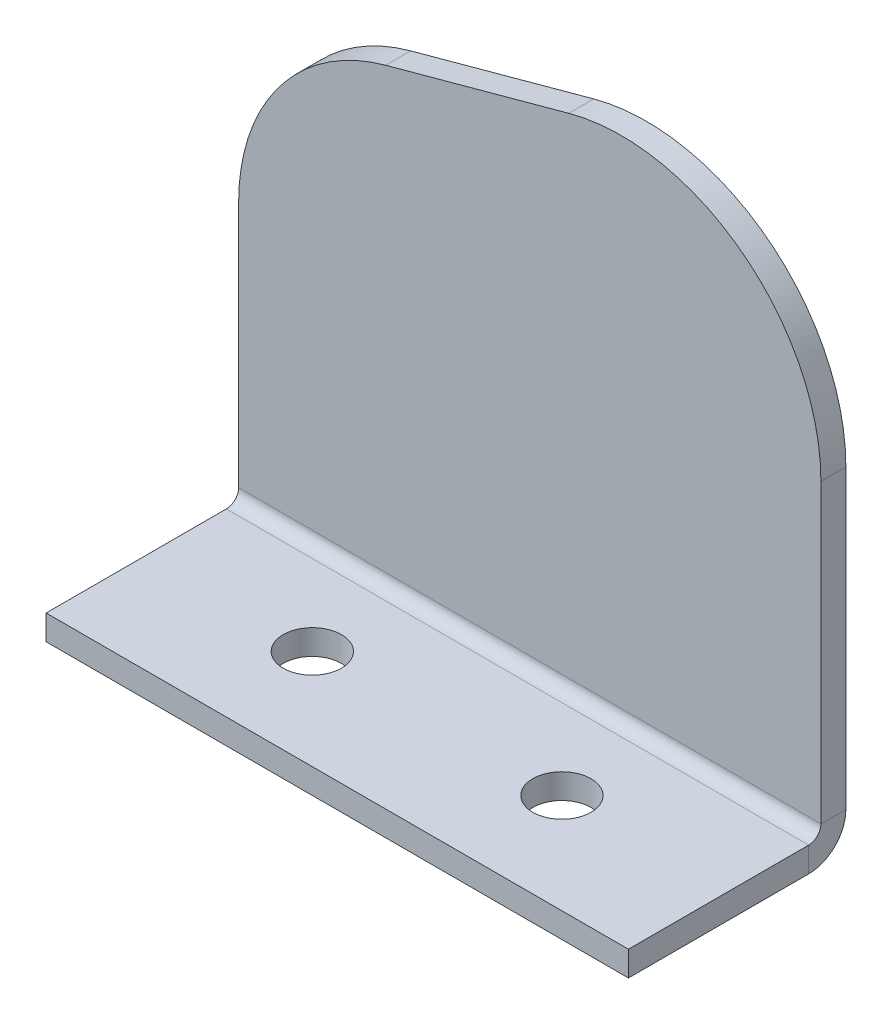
SolidWorks part; units mm, degrees
ref_plane "Front Plane" through (0, 0, 0) normal (0, 0, 1) x (1, 0, 0)
ref_plane "Top Plane" through (0, 0, 0) normal (0, 1, 0) x (1, 0, 0)
ref_plane "Right Plane" through (0, 0, 0) normal (1, 0, 0) x (0, 0, -1)
sketch "Sketch1" plane through (0, 0, 0) normal (0, 1, 0) x (1, 0, 0)
  line L0 (0, 28) -> (0, 0)
  line L1 (0, 0) -> (35, 0)
  line L2 (35, 0) -> (35, 31)
  line L3 (8.8426, 39.5772) -> (19.8426, 42.5772)
  arc A0 (8.8426, 39.5772) -> (0, 28) centre (12, 28) ccw
  arc A1 (35, 31) -> (19.8426, 42.5772) centre (23, 31) ccw
  circle A2 centre (25, 6) radius 1.75
  circle A3 centre (10, 6) radius 1.75
  dimension "D2" = 24
  dimension "D3" = 24
  dimension "D4" = 6
  dimension "D6" = 15
  dimension "D1" = 35
  dimension "D5" = 10
  dimension "D7" = 28
  dimension "D8" = 31
sheet metal parameters "Sheet-Metal1" thickness 1.5 parameters "D1"=0.7366
base flange "Base-Flange1" sketch "Sketch1" thickness 1.5 reverse thickness direction yes parameters "D1"=0.7366
sketch "Sketch3" plane through (0, 1.5, 0) normal (0, 1, 0) x (-1, 0, 0)
  line L1 (0, -12) -> (-35, -12)
sketched bend "Sketched Bend1" parameters "D1"=0.7366
bend "SketchBend1" bend radius 0.7366 bend angle 90 parameters "D5"=1
flat pattern "Flat-Pattern1"
sketch "Bend-Lines1" plane through (0, 0, 0) normal (0, 1, 0) x (-1, 0, 0)
bend of the flat pattern "Flatten-<SketchBend1>1"
